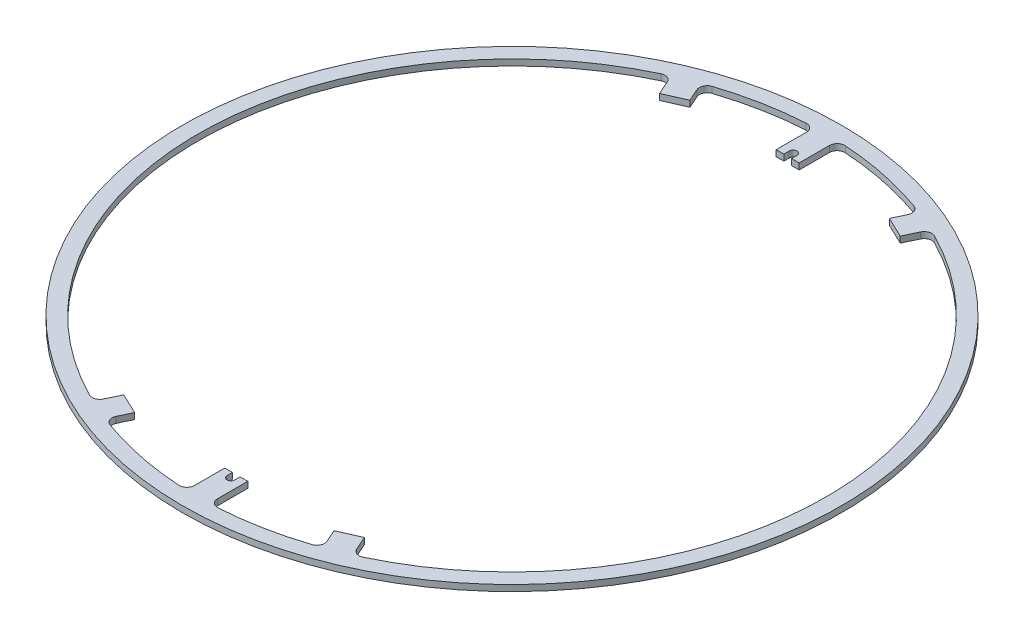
SolidWorks part; units mm, degrees
ref_plane "前视基准面" through (0, 0, 0) normal (0, 0, 1) x (1, 0, 0)
ref_plane "上视基准面" through (0, 0, 0) normal (0, 1, 0) x (1, 0, 0)
ref_plane "右视基准面" through (0, 0, 0) normal (1, 0, 0) x (0, 0, -1)
sketch "草图1" plane through (0, 0, 0) normal (0, 1, 0) x (1, 0, 0)
  circle A0 centre (0, 0) radius 43
  circle A1 centre (0, 0) radius 41
  circle A2 centre (0, 0) radius 35 construction
  dimension "D1" = 86
  dimension "D2" = 2
  dimension "D3" = 70
extrude "凸台-拉伸1" add sketch "草图1" along normal blind 0.8
sketch "草图2" plane through (0, 0.8, 0) normal (0, 1, 0) x (1, 0, 0)
  line L0 (0, 0) -> (0, 47.3857) construction
  line L1 (-1.5, 40.9726) -> (-1.5, 35.9726)
  line L2 (-1.5, 35.9726) -> (1.5, 35.9726)
  line L3 (1.5, 40.9726) -> (1.5, 35.9726)
  line L4 (0, 0) -> (51.4644, 0) construction
  line L5 (1.5, -40.9726) -> (1.5, -35.9726)
  line L6 (-1.5, -40.9726) -> (-1.5, -35.9726)
  line L7 (-1.5, -35.9726) -> (1.5, -35.9726)
  circle A0 centre (0, 0) radius 41 construction
  circle A1 centre (0, 0) radius 41
  point P10 (0, 35.9726)
  dimension "D1" = 5
  dimension "D2" = 3
extrude "凸台-拉伸2" add sketch "草图2" against normal up to surface (0.8 mm away) contours L7 L6 L5 M8 | L3 L1 L2 M8
fillet "圆角1" radius 1 2 edges at (1.5, 0.4, -40.9726) (-1.5, 0.4, -40.9726)
fillet "圆角2" radius 1 2 edges at (1.5, 0.4, 40.9726) (-1.5, 0.4, 40.9726)
sketch "草图3" plane through (0, 0, 0) normal (0, -1, 0) x (1, 0, 0)
  line L0 (0, 36.6726) -> (0, 35.9726) construction
  line L1 (1.5, 35.9726) -> (-1.5, 35.9726) construction
  line L2 (-0.5, 36.6726) -> (-0.5, 33.6726)
  line L3 (-0.5, 33.6726) -> (0.5, 33.6726)
  line L4 (0.5, 33.6726) -> (0.5, 36.6726)
  line L5 (0, 0) -> (11.294, 0) construction
  line L6 (0, -36.6726) -> (0, -35.9726) construction
  line L7 (0.5, -33.6726) -> (0.5, -36.6726)
  line L8 (-0.5, -33.6726) -> (0.5, -33.6726)
  line L9 (-0.5, -36.6726) -> (-0.5, -33.6726)
  arc A0 (0.5, 36.6726) -> (-0.5, 36.6726) centre (0, 36.6726) ccw
  arc A1 (0.5, -36.6726) -> (-0.5, -36.6726) centre (0, -36.6726) cw
  dimension "D1" = 1
  dimension "D2" = 3
  dimension "D3" = 0.7
extrude "切除-拉伸1" cut sketch "草图3" against normal through all
sketch "草图4" plane through (0, 0.8, 0) normal (0, 1, 0) x (1, 0, 0)
  line L0 (0, 0) -> (-17.651, -37.006) construction
  line L1 (0, 0) -> (0, -48.4381) construction
  line L2 (-17.651, -37.006) -> (-16.3594, -34.2982)
  line L3 (-16.3594, -34.2982) -> (-13.6517, -35.5898)
  line L4 (-13.6517, -35.5898) -> (-14.8959, -38.1983)
  line L5 (17.651, 37.006) -> (16.3594, 34.2982)
  line L6 (16.3594, 34.2982) -> (13.6517, 35.5898)
  line L7 (13.6517, 35.5898) -> (14.8959, 38.1983)
  arc A0 (-2.5625, 40.9198) -> (-2.5625, -40.9198) centre (0, 0) ccw construction
  arc A1 (-17.651, -37.006) -> (-14.8959, -38.1983) centre (0, 0) ccw
  arc A2 (17.651, 37.006) -> (14.8959, 38.1983) centre (0, 0) ccw
  point P16 (0, 0)
  dimension "D1" = 3
  dimension "D2" = 3
  dimension "D4" = 25.5
  dimension "D3" = 2
extrude "凸台-拉伸3" add sketch "草图4" against normal up to surface (0.8 mm away)
fillet "圆角3" radius 1 4 edges at (17.651, 0.4, -37.006) (14.8959, 0.4, -38.1983) (-14.8959, 0.4, 38.1983) (-17.651, 0.4, 37.006)
sketch "草图5" plane through (0, 0, 0) normal (0, -1, 0) x (1, 0, 0)
  line L0 (0, 0) -> (-16.3594, 34.2982) construction
  line L1 (0, 0) -> (18.3032, 41.1096) construction
  line L2 (16.6762, 37.4554) -> (15.456, 34.7147)
  line L3 (15.456, 34.7147) -> (12.7154, 35.9349)
  line L4 (12.7154, 35.9349) -> (13.8909, 38.5752)
  line L5 (-12.7154, -35.9349) -> (-13.8909, -38.5752)
  line L6 (-15.456, -34.7147) -> (-12.7154, -35.9349)
  line L7 (-16.6762, -37.4554) -> (-15.456, -34.7147)
  arc A0 (18.5706, -36.5532) -> (2.5625, 40.9198) centre (0, 0) ccw construction
  arc A1 (16.6762, 37.4554) -> (13.8909, 38.5752) centre (0, 0) ccw
  arc A2 (-16.6762, -37.4554) -> (-13.8909, -38.5752) centre (0, 0) ccw
  point P19 (0, 0)
  dimension "D1" = 49.5
  dimension "D2" = 3
  dimension "D3" = 3
  dimension "D4" = 2
extrude "凸台-拉伸4" add sketch "草图5" against normal up to surface (0.8 mm away)
fillet "圆角4" radius 1 2 edges at (16.6762, 0.4, 37.4554) (13.8909, 0.4, 38.5752)
fillet "圆角5" radius 1 2 edges at (-16.6762, 0.4, -37.4554) (-13.8909, 0.4, -38.5752)
